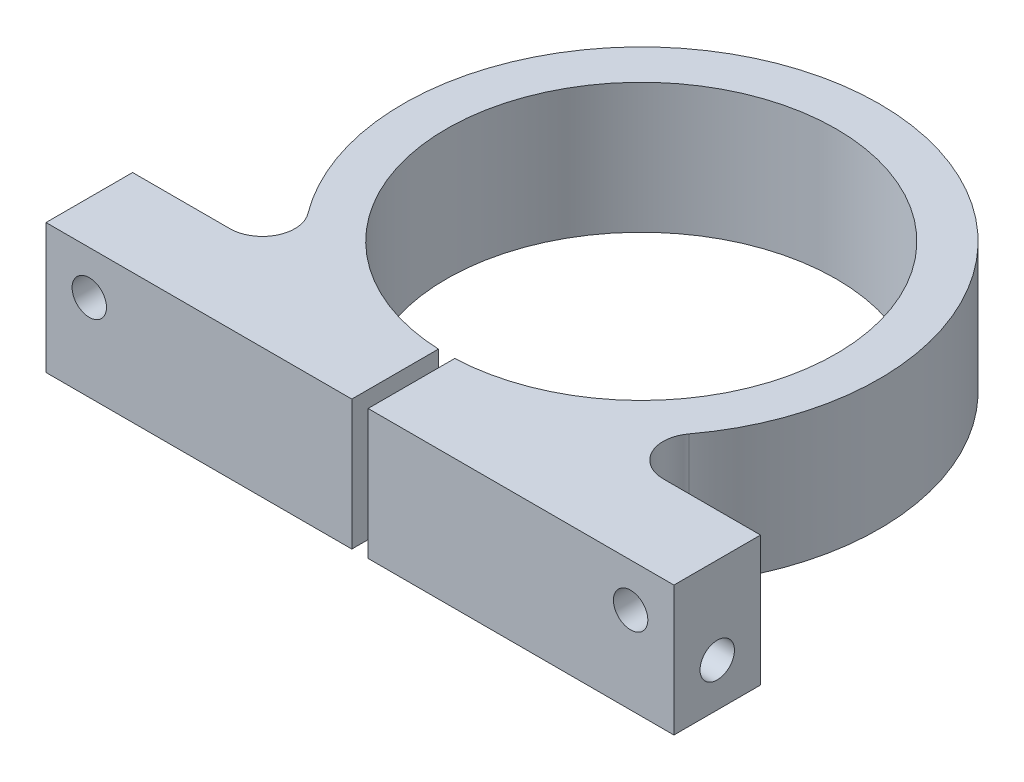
SolidWorks part; units mm, degrees
ref_plane "Front Plane" through (0, 0, 0) normal (0, 0, 1) x (1, 0, 0)
ref_plane "Top Plane" through (0, 0, 0) normal (0, 1, 0) x (1, 0, 0)
ref_plane "Right Plane" through (0, 0, 0) normal (1, 0, 0) x (0, 0, -1)
sketch "Sketch1" plane through (0, 0, 0) normal (0, 1, 0) x (1, 0, 0)
  line L0 (2.3876, -82.5001) -> (92.075, -82.5001)
  line L1 (-92.075, -57.1001) -> (-63.5374, -57.1001)
  line L2 (-92.075, -57.1001) -> (-92.075, -82.5001)
  line L3 (-92.075, -82.5001) -> (-2.3876, -82.5001)
  line L4 (92.075, -57.1001) -> (92.075, -82.5001)
  line L5 (63.5374, -57.1001) -> (92.075, -57.1001)
  line L6 (-69.85, 0) -> (69.85, 0) construction
  line L8 (-2.3876, -82.5001) -> (-2.3876, -57.1001)
  line L10 (2.3876, -82.5001) -> (2.3876, -57.1001)
  arc A0 (2.3876, -57.1001) -> (-2.3876, -57.1001) centre (0, 0) ccw
  arc A1 (55.9129, -41.8661) -> (-55.9129, -41.8661) centre (0, 0) ccw
  arc A5 (-63.5374, -57.1001) -> (-55.9129, -41.8661) centre (-63.5374, -47.5751) ccw
  arc A6 (63.5374, -57.1001) -> (55.9129, -41.8661) centre (63.5374, -47.5751) cw
  dimension "D3" = 12.7
  dimension "D4" = 57.15
  dimension "D10" = 9.525
  dimension "D1" = 22.225
  dimension "D5" = 25.4
  dimension "D6" = 4.7752
  dimension "D7" = 2.3876
  dimension "D9" = 22.225
extrude "Extrude1" add sketch "Sketch1" along normal blind 38.1
hole_wizard "3/8 Clearance Hole2" positions "3DSketch1" profile "Sketch2" hole size "3/8" standard "Ansi Inch"
sketch3d "3DSketch1"
  line L2 (-92.075, 38.1, 82.5001) -> (-92.075, 0, 82.5001) construction
  line L3 (-92.075, 38.1, 57.1001) -> (-92.075, 38.1, 82.5001) construction
  point P0 (-92.075, 12.7, 69.8001)
  dimension "D1" = 25.4
  dimension "D2" = 12.7
sketch "Sketch2" plane through (-92.075, 12.7, 69.8001) normal (0, 1, 0) x (0, 0, 1)
  line L0 (0, 0) -> (0, 184.15)
  line L1 (0, 184.15) -> (5.0419, 184.15)
  line L2 (5.0419, 184.15) -> (5.0419, 0)
  line L5 (5.0419, 0) -> (0, 0)
  line L11 (0, -6.35) -> (0, 107.95) construction
  dimension "Thru Hole Dia." = 10.0838
  dimension "Thru Hole Depth" = 184.15
hole_wizard "3/8 Clearance Hole1" positions "3DSketch2" profile "Sketch3" hole size "3/8" standard "Ansi Inch"
sketch3d "3DSketch2"
  line L0 (-92.075, 38.1, 57.1001) -> (-92.075, 0, 57.1001) construction
  line L1 (-63.5374, 38.1, 57.1001) -> (-92.075, 38.1, 57.1001) construction
  point P0 (-79.375, 25.4, 57.1001)
  dimension "D1" = 12.7
  dimension "D2" = 12.7
sketch "Sketch3" plane through (-79.375, 25.4, 57.1001) normal (1, 0, 0) x (0, 1, 0)
  line L0 (0, 0) -> (0, 25.4)
  line L1 (0, 25.4) -> (5.0419, 25.4)
  line L2 (5.0419, 25.4) -> (5.0419, 0)
  line L5 (5.0419, 0) -> (0, 0)
  line L11 (0, -6.35) -> (0, 107.95) construction
  dimension "Thru Hole Dia." = 10.0838
  dimension "Thru Hole Depth" = 25.4
hole_wizard "3/8 Clearance Hole3" positions "3DSketch3" profile "Sketch4" hole size "3/8" standard "Ansi Inch"
sketch3d "3DSketch3"
  line L0 (92.075, 38.1, 57.1001) -> (92.075, 0, 57.1001) construction
  line L1 (92.075, 38.1, 57.1001) -> (63.5374, 38.1, 57.1001) construction
  point P0 (79.375, 25.4, 57.1001)
  dimension "D1" = 12.7
  dimension "D2" = 12.7
sketch "Sketch4" plane through (79.375, 25.4, 57.1001) normal (1, 0, 0) x (0, 1, 0)
  line L0 (0, 0) -> (0, 25.4)
  line L1 (0, 25.4) -> (5.0419, 25.4)
  line L2 (5.0419, 25.4) -> (5.0419, 0)
  line L5 (5.0419, 0) -> (0, 0)
  line L11 (0, -6.35) -> (0, 107.95) construction
  dimension "Thru Hole Dia." = 10.0838
  dimension "Thru Hole Depth" = 25.4
